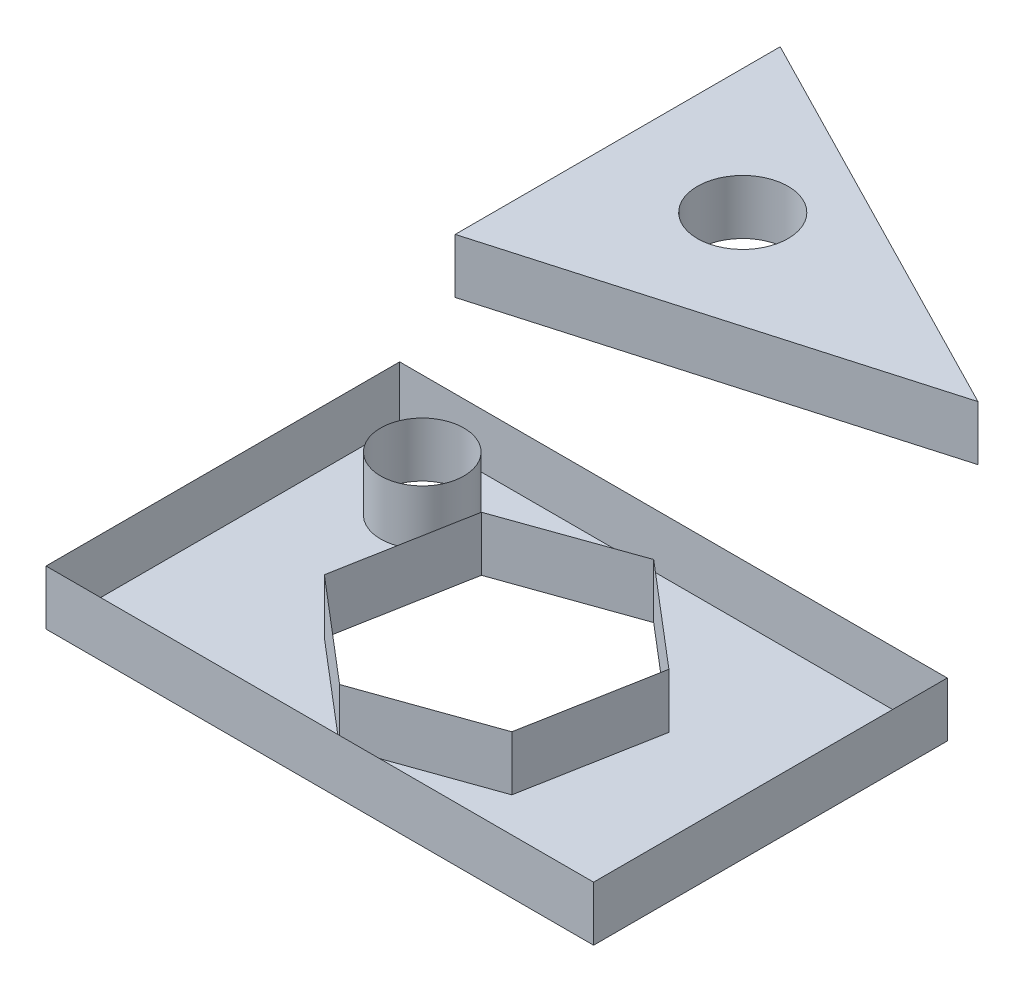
SolidWorks part; units mm, degrees
ref_plane "Front Plane" through (0, 0, 0) normal (0, 0, 1) x (1, 0, 0)
ref_plane "Top Plane" through (0, 0, 0) normal (0, 1, 0) x (1, 0, 0)
ref_plane "Right Plane" through (0, 0, 0) normal (1, 0, 0) x (0, 0, -1)
sketch "Sketch1" plane through (0, 0, 0) normal (0, 1, 0) x (1, 0, 0)
  line L1 (-205.7504, 38.1055) -> (-80.7821, 38.1055)
  line L2 (-205.7504, 38.1055) -> (-205.7504, -81.5293)
  line L3 (-205.7504, -81.5293) -> (-80.7821, -81.5293)
  line L4 (-80.7821, 38.1055) -> (-80.7821, -81.5293)
sketch "Sketch2" plane through (0, 0, 0) normal (0, 1, 0) x (1, 0, 0)
  line L0 (0, 0) -> (0, 151.0888)
  line L1 (0, 151.0888) -> (188.8508, 54.2005)
  line L2 (188.8508, 54.2005) -> (0, 0)
  line L4 (38.4002, -64.2241) -> (292.9816, -64.2241)
  line L5 (38.4002, -64.2241) -> (38.4002, -228.6412)
  line L6 (38.4002, -228.6412) -> (292.9816, -228.6412)
  line L7 (292.9816, -64.2241) -> (292.9816, -228.6412)
  line L8 (213.4249, -187.095) -> (224.7725, -125.425)
  line L9 (224.7725, -125.425) -> (177.0385, -84.7627)
  line L10 (177.0385, -84.7627) -> (117.9569, -105.7704)
  line L11 (117.9569, -105.7704) -> (106.6093, -167.4404)
  line L12 (106.6093, -167.4404) -> (154.3433, -208.1027)
  line L13 (154.3433, -208.1027) -> (213.4249, -187.095)
  circle A0 centre (58.0016, 75.6758) radius 21.0766
  circle A1 centre (165.6909, -146.4327) radius 54.3044 construction
  circle A2 centre (79.9465, -95.2665) radius 19.3435
extrude "Boss-Extrude1" add sketch "Sketch2" against normal blind 25.4
other "DeleteFace1"
